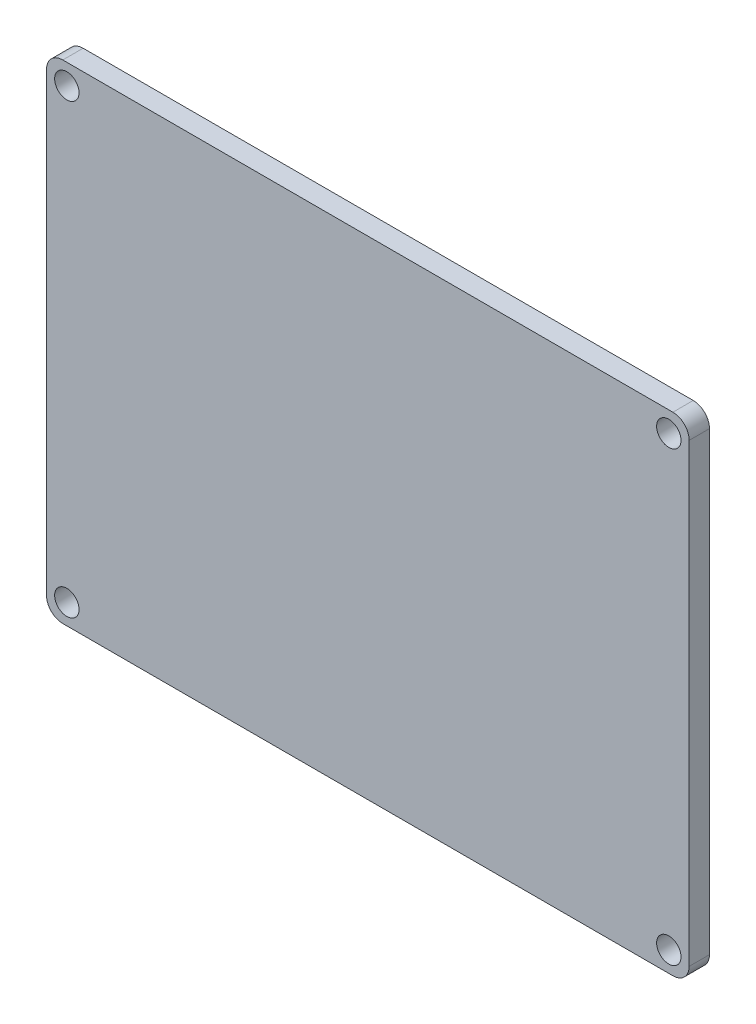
SolidWorks part; units mm, degrees
ref_plane "Front Plane" through (0, 0, 0) normal (0, 0, 1) x (1, 0, 0)
ref_plane "Top Plane" through (0, 0, 0) normal (0, 1, 0) x (1, 0, 0)
ref_plane "Right Plane" through (0, 0, 0) normal (1, 0, 0) x (0, 0, -1)
sketch "Sketch1" plane through (0, 0, 0) normal (0, 0, 1) x (1, 0, 0)
  line L0 (0, -38.1) -> (0, 38.1) construction
  line L1 (-50.165, 38.1) -> (50.165, 38.1)
  line L2 (-50.165, 38.1) -> (-50.165, -38.1)
  line L3 (-50.165, -38.1) -> (50.165, -38.1)
  line L4 (50.165, 38.1) -> (50.165, -38.1)
  line L5 (-50.165, 38.1) -> (50.165, -38.1) construction
  line L6 (-50.165, -38.1) -> (50.165, 38.1) construction
  line L7 (-50.165, 0) -> (50.165, 0) construction
  circle A0 centre (-46.99, 34.925) radius 1.905
  circle A2 centre (-46.99, -34.925) radius 1.905
  circle A3 centre (46.99, -34.925) radius 1.905
  circle A4 centre (46.99, 34.925) radius 1.905
  point P0 (0, 0)
  dimension "D3" = 3.81
  dimension "D4" = 46.99
  dimension "D5" = 34.925
  dimension "D1" = 76.2
  dimension "D2" = 100.33
extrude "Boss-Extrude1" add sketch "Sketch1" along normal blind 3.175
fillet "Fillet1" radius 2.54 4 edges at (-50.165, 38.1, 1.5875) (50.165, 38.1, 1.5875) (50.165, -38.1, 1.5875) (-50.165, -38.1, 1.5875)
